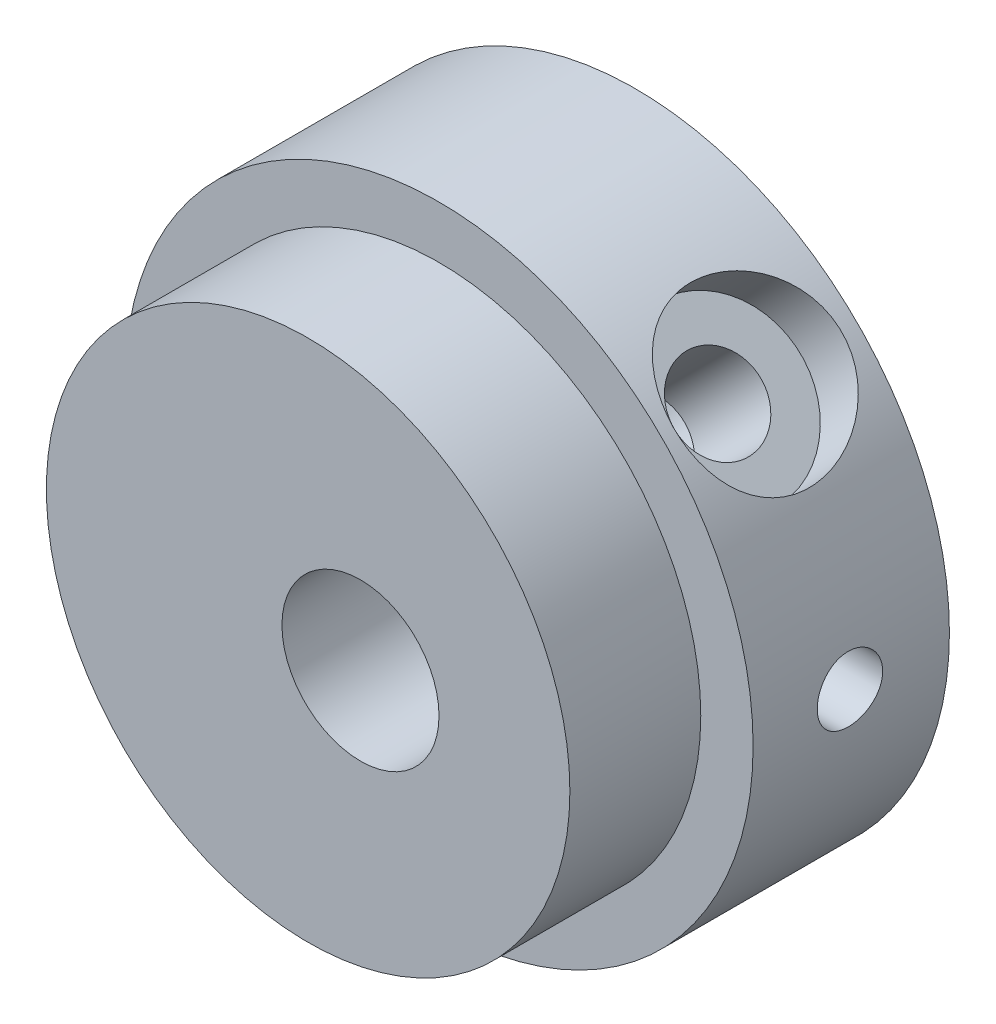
SolidWorks part; units mm, degrees
ref_plane "Front Plane" through (0, 0, 0) normal (0, 0, 1) x (1, 0, 0)
ref_plane "Top Plane" through (0, 0, 0) normal (0, 1, 0) x (1, 0, 0)
ref_plane "Right Plane" through (0, 0, 0) normal (1, 0, 0) x (0, 0, -1)
sketch "Sketch1" plane through (0, 0, 0) normal (0, 0, 1) x (1, 0, 0)
  line L0 (-471.5362, 0) -> (23105.2727, 0) construction
  line L1 (0, -471.5362) -> (0, 23105.2727) construction
  circle A0 centre (0, 0) radius 30.48
  dimension "D1" = 60.96
extrude "Boss-Extrude1" add sketch "Sketch1" along normal blind 19.05
sketch "Sketch2" plane through (0, 0, 19.05) normal (0, 0, 1) x (1, 0, 0)
  circle A0 centre (0, 0) radius 25.4
  dimension "D1" = 50.8
extrude "Boss-Extrude2" add sketch "Sketch2" along normal blind 12.7
sketch "Sketch3" plane through (0, 0, 0) normal (0, 0, -1) x (-1, 0, 0)
  circle A0 centre (-5.08, 0) radius 7.62
  dimension "D2" = 15.24
  dimension "D1" = 5.08
extrude "Cut-Extrude1" cut sketch "Sketch3" against normal blind 47.752
sketch "Sketch4" plane through (0, 0, 0) normal (1, 0, 0) x (0, 0, -1)
  circle A0 centre (-9.652, 0) radius 3.175
  dimension "D1" = 6.35
  dimension "D2" = 9.652
extrude "Cut-Extrude2" cut sketch "Sketch4" along normal blind 47.752
ref_plane "Plane1" through (0, 0, 9.652) normal (0, 0, -1) x (-1, 0, 0)
sketch "Sketch5" plane through (0, 0, 9.652) normal (0, 0, -1) x (-1, 0, 0)
  line L0 (0, 0) -> (-30.48, 0) construction
  line L1 (0, 0) -> (-21.5526, -21.5526) construction
  line L2 (0, 0) -> (-21.5526, 21.5526) construction
  circle A0 centre (0, 0) radius 30.48 construction
  dimension "D1" = 45
ref_plane "Plane2" through (21.5526, 21.5526, 9.652) normal (0.7071, 0.7071, 0) x (0.7071, -0.7071, 0)
hole_wizard "CBORE for 5/16 Pan Head Machine Screw1" positions "Sketch6" profile "Sketch7" counterbore size "5/16" standard "ANSI Inch"
sketch "Sketch6" plane through (21.5526, 21.5526, 9.652) normal (0.7071, 0.7071, 0) x (0.7071, -0.7071, 0)
  point P0 (0, 0.0014)
sketch "Sketch7" plane through (21.5526, 21.5526, 9.6506) normal (0, 0, 1) x (-0.7071, 0.7071, 0)
  line L0 (0, 0) -> (0, 18.5355)
  line L1 (0, 18.5355) -> (4.2164, 16.002)
  line L2 (4.2164, 16.002) -> (4.2164, 5.5372)
  line L3 (4.2164, 5.5372) -> (8.1356, 5.5372)
  line L4 (8.1356, 5.5372) -> (8.1356, 0)
  line L5 (8.1356, 0) -> (0, 0)
  line L10 (0, 18.5355) -> (-4.2164, 16.002) construction
  line L11 (0, -6.35) -> (0, 107.95) construction
  dimension "Hole Dia." = 8.4328
  dimension "Hole Depth" = 16.002
  dimension "C'Bore Dia." = 16.2712
  dimension "C'Bore Depth" = 5.5372
  dimension "Drill Angle" = 118
